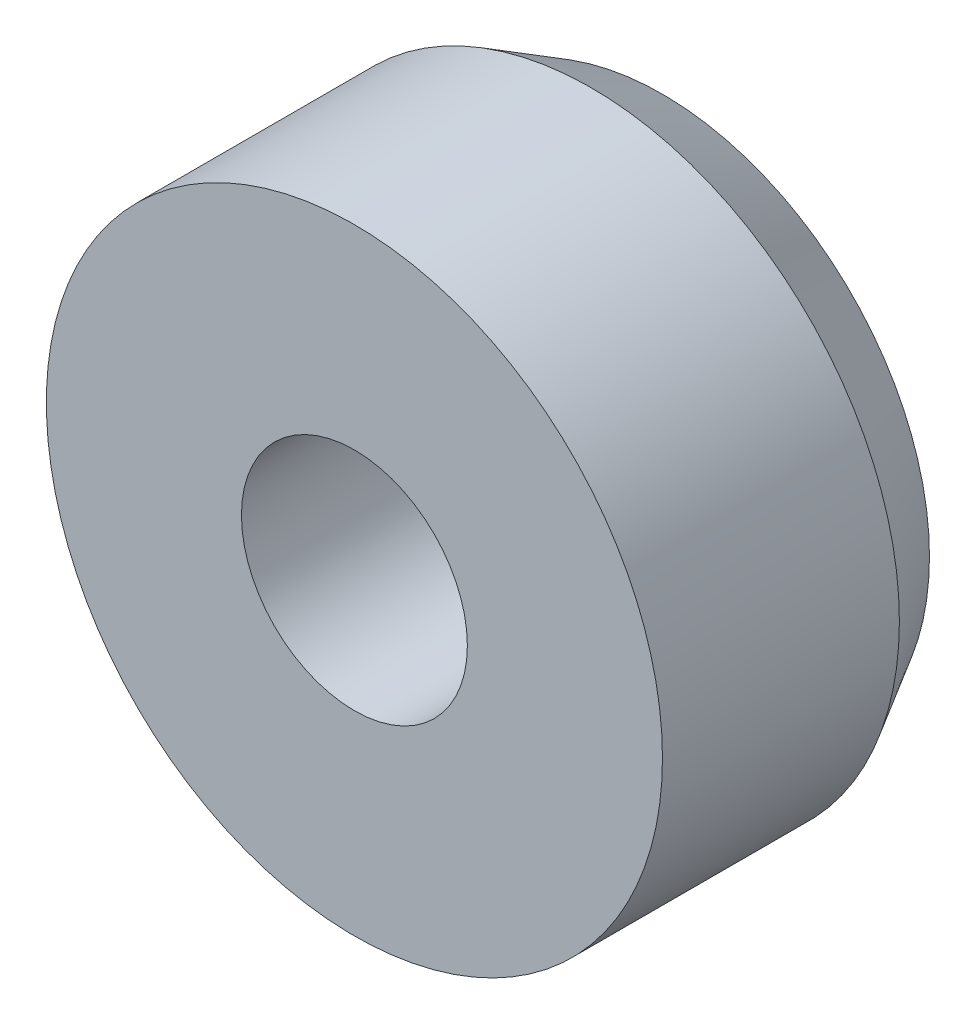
SolidWorks part; units mm, degrees
ref_plane "Frontal" through (0, 0, 0) normal (0, 0, 1) x (1, 0, 0)
ref_plane "Horizontal" through (0, 0, 0) normal (0, 1, 0) x (1, 0, 0)
ref_plane "Profil" through (0, 0, 0) normal (1, 0, 0) x (0, 0, -1)
sketch "Esquisse1" plane through (0, 0, 0) normal (0, 0, 1) x (1, 0, 0)
  circle A0 centre (0, 0) radius 15
  circle A1 centre (0, 0) radius 5.5
  dimension "D1" = 30
  dimension "D2" = 11
extrude "Base-Extrusion" add sketch "Esquisse1" along normal blind 15
sketch "Esquisse2" plane through (0, 0, 0) normal (0, 0, -1) x (-1, 0, 0)
  circle A0 centre (0, 0) radius 8.5
  dimension "D1" = 17
extrude "Enlèv. mat.-Extru.1" cut sketch "Esquisse2" against normal blind 4
chamfer "Chanfrein1" distance 2 angle 60 1 edges at (15, 0, 0)
